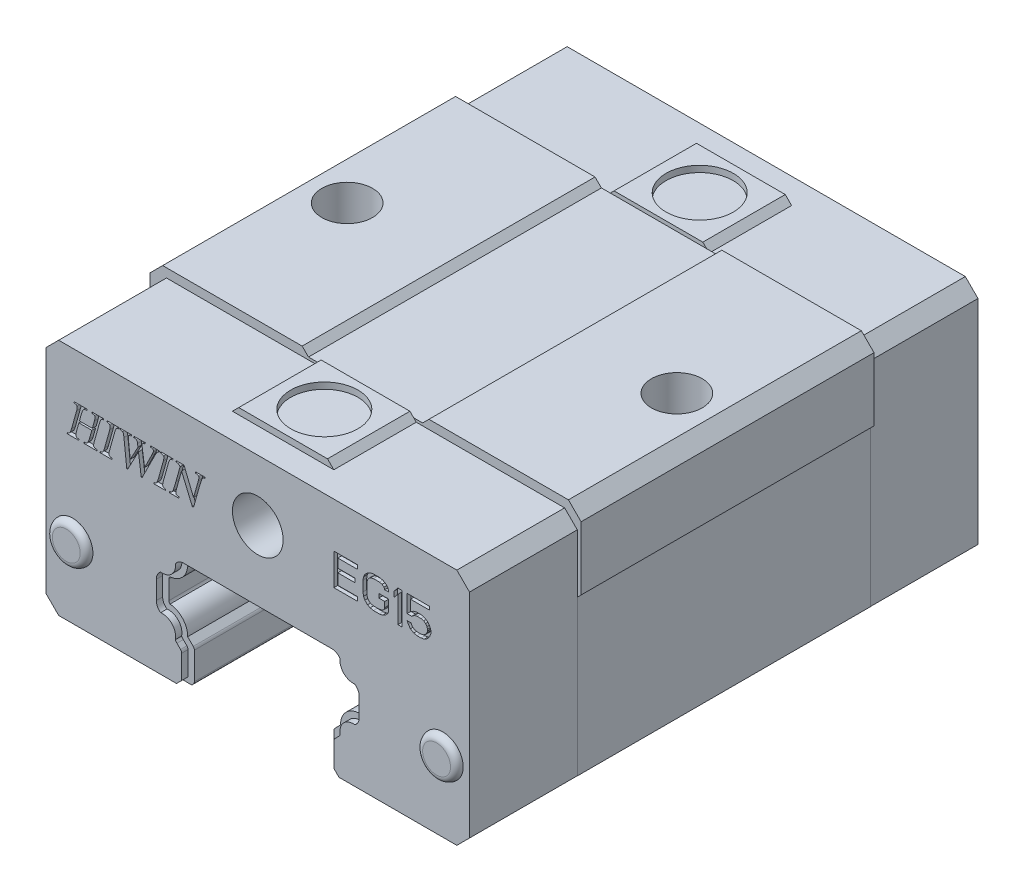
SolidWorks part; units mm, degrees
ref_plane "前视基准面" through (0, 0, 0) normal (0, 0, 1) x (1, 0, 0)
ref_plane "上视基准面" through (0, 0, 0) normal (0, 1, 0) x (1, 0, 0)
ref_plane "右视基准面" through (0, 0, 0) normal (1, 0, 0) x (0, 0, -1)
imported_body "输入1"
sketch "草图1" plane through (0, 0, 31.6) normal (0, 0, 1) x (1, 0, 0)
  line L0 (0, 0) -> (0, -24) construction
  line L20 (-7.5, -21.5071) -> (-7.5, -23.3)
  line L21 (5.5, -19.1757) -> (5.5, -17.018)
  line L22 (7.3536, -21.1536) -> (5.5879, -19.3879)
  line L23 (-6.0294, -16.3644) -> (-5.5879, -16.8059)
  line L24 (2.05, -23.7) -> (2.35, -24)
  line L25 (5.5879, -16.8059) -> (6.0294, -16.3644)
  line L26 (-2.35, -24) -> (-2.05, -23.7)
  line L27 (-7.5, -13.1694) -> (-7.5, -14.6306)
  line L28 (-5.5, -17.018) -> (-5.5, -19.1757)
  line L29 (-5.5879, -19.3879) -> (-7.3536, -21.1536)
  line L30 (-6.8, -24) -> (-2.35, -24)
  line L31 (-2.05, -23.7) -> (2.05, -23.7)
  line L32 (-2.35, -24) -> (2.35, -24) construction
  line L33 (2.35, -24) -> (6.8, -24)
  line L34 (7.5, -23.3) -> (7.5, -21.5071)
  line L35 (-7.5, -23.3) -> (-6.8, -24)
  line L36 (6.8, -24) -> (7.5, -23.3)
  line L37 (7.5, -14.6306) -> (7.5, -13.1694)
  line L38 (5.8306, -11.5) -> (-5.8306, -11.5)
  arc A16 (6.0328, -11.5785) -> (7.4215, -12.9672) centre (7.529, -11.471) ccw
  arc A17 (-7.4215, -12.9672) -> (-7.5, -13.1694) centre (-7.2, -13.1694) ccw
  arc A18 (7.4215, -14.8328) -> (6.0294, -16.3644) centre (7.529, -16.329) ccw
  arc A19 (-5.5, -17.018) -> (-5.5879, -16.8059) centre (-5.8, -17.018) ccw
  arc A20 (5.5879, -16.8059) -> (5.5, -17.018) centre (5.8, -17.018) ccw
  arc A21 (-6.0294, -16.3644) -> (-7.4215, -14.8328) centre (-7.529, -16.329) ccw
  arc A22 (-7.3536, -21.1536) -> (-7.5, -21.5071) centre (-7, -21.5071) ccw
  arc A23 (-7.4215, -12.9672) -> (-6.0328, -11.5785) centre (-7.529, -11.471) ccw
  arc A24 (-5.5879, -19.3879) -> (-5.5, -19.1757) centre (-5.8, -19.1757) ccw
  arc A25 (-7.5, -14.6306) -> (-7.4215, -14.8328) centre (-7.2, -14.6306) ccw
  arc A26 (-5.8306, -11.5) -> (-6.0328, -11.5785) centre (-5.8306, -11.8) ccw
  arc A27 (5.5, -19.1757) -> (5.5879, -19.3879) centre (5.8, -19.1757) ccw
  arc A28 (7.5, -21.5071) -> (7.3536, -21.1536) centre (7, -21.5071) ccw
  arc A29 (7.5, -13.1694) -> (7.4215, -12.9672) centre (7.2, -13.1694) ccw
  arc A30 (6.0328, -11.5785) -> (5.8306, -11.5) centre (5.8306, -11.8) ccw
  arc A31 (7.4215, -14.8328) -> (7.5, -14.6306) centre (7.2, -14.6306) ccw
  dimension "D1" = 24
extrude "切除-拉伸1" cut sketch "草图1" against normal through all
sketch "草图3" plane through (0, 0, 23.1) normal (0, 0, 1) x (1, 0, 0)
  line L0 (16.7, -6.3) -> (17, -6) construction
  line L1 (16.7, -18.5) -> (16.71, -18.5)
  line L2 (16.7, -18.5) -> (16.7, -6.29)
  line L3 (16.7, -6.29) -> (16.71, -6.29)
  line L4 (16.71, -18.5) -> (16.71, -6.29)
  dimension "D1" = 0.01
extrude "凸台-拉伸1" add sketch "草图3" against normal up to surface (23.1 mm away)
